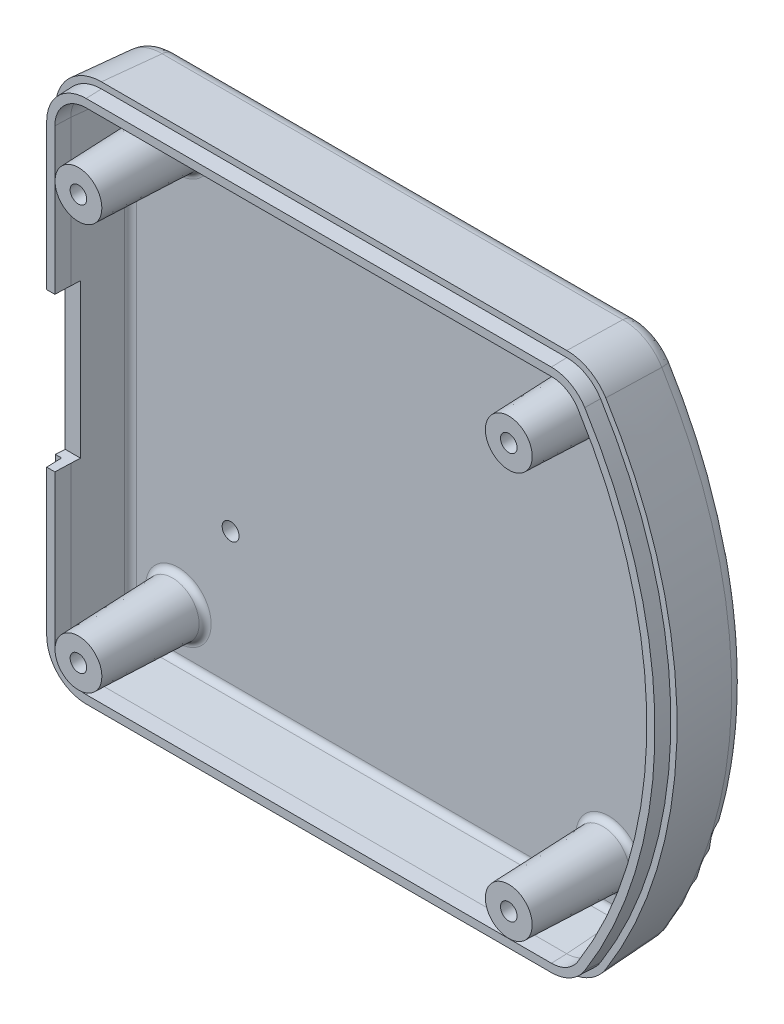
SolidWorks part; units mm, degrees
ref_plane "Front" through (0, 0, 0) normal (0, 0, 1) x (1, 0, 0)
ref_plane "Top" through (0, 0, 0) normal (0, 1, 0) x (1, 0, 0)
ref_plane "Right" through (0, 0, 0) normal (1, 0, 0) x (0, 0, -1)
sketch "Sketch1" plane through (0, 0, 0) normal (0, 0, 1) x (1, 0, 0)
  line L0 (0, 0) -> (0, 87.63)
  line L1 (0, 87.63) -> (87.63, 87.63)
  line L2 (0, 0) -> (87.63, 0)
  arc A0 (87.63, 87.63) -> (87.63, 0) centre (25.2867, 43.815) cw
  dimension "D3" = 76.2
  dimension "D1" = 87.63
  dimension "D2" = 87.63
extrude "Boss-Extrude1" add sketch "Sketch1" along normal blind 11.938 draft 3
fillet "Fillet1" radius 7.62 4 edges at (-0.3128, 87.9428, 5.969) (-0.3128, -0.3128, 5.969)
fillet "Fillet2" radius 2.54 8 edges at (86.062, 87.2012, 0) (101.4867, 43.815, 0) (88.3125, 1.6798, 0) (45.5764, 0, 0) (2.2275, 2.2275, 0) (0, 43.815, 0) (2.2275, 85.4025, 0) (45.5764, 87.63, 0)
shell "Shell1" thickness 2.54
sketch "Sketch2" plane through (0, 0, 2.54) normal (0, 0, 1) x (1, 0, 0)
  line L0 (-0.6256, 80.6461) -> (-0.6256, 6.9839) construction
  line L1 (83.8899, 88.2556) -> (6.9839, 88.2556) construction
  line L2 (6.9839, -0.6256) -> (83.8899, -0.6256) construction
  circle A0 centre (10.2964, 77.3336) radius 4.445
  circle A1 centre (81.4164, 77.3336) radius 4.445
  circle A2 centre (10.2964, 10.2964) radius 4.445
  circle A3 centre (81.4164, 10.2964) radius 4.445
  dimension "D5" = 8.89
  dimension "D1" = 10.922
  dimension "D2" = 10.922
  dimension "D3" = 10.922
  dimension "D4" = 71.12
extrude "Boss-Extrude2" add sketch "Sketch2" along normal blind 16.51 draft 2
sketch "Sketch3" plane through (0, 0, 11.938) normal (0, 0, 1) x (1, 0, 0)
  line L0 (1.9178, 80.6391) -> (1.9178, 6.9909) construction
  line L1 (6.9909, 1.9178) -> (83.8861, 1.9178) construction
  line L2 (83.8861, 85.7122) -> (6.9909, 85.7122) construction
  line L3 (1.9178, 80.6391) -> (1.9178, 6.9909)
  line L4 (6.9909, 1.9178) -> (83.8861, 1.9178)
  line L5 (83.8861, 85.7122) -> (6.9909, 85.7122)
  line L6 (83.8861, 87.2362) -> (6.9909, 87.2362)
  line L7 (0.3938, 80.6391) -> (0.3938, 6.9909)
  line L8 (6.9909, 0.3938) -> (83.8861, 0.3938)
  arc A0 (88.1814, 4.2917) -> (88.1814, 83.3383) centre (25.2867, 43.815) ccw construction
  arc A1 (88.1814, 4.2917) -> (88.1814, 83.3383) centre (25.2867, 43.815) ccw
  arc A2 (89.4718, 3.4808) -> (89.4718, 84.1492) centre (25.2867, 43.815) ccw
  ellipse E0 centre (7.0048, 7.0048) end of major axis (10.6068, 10.6068) minor radius 5.08 (1.9178, 6.9909) -> (6.9909, 1.9178) ccw construction
  ellipse E1 centre (7.0048, 80.6252) end of major axis (10.6068, 77.0232) minor radius 5.08 (6.9909, 85.7122) -> (1.9178, 80.6391) ccw construction
  ellipse E2 centre (7.0048, 7.0048) end of major axis (10.6068, 10.6068) minor radius 5.08 (1.9178, 6.9909) -> (6.9909, 1.9178) ccw
  ellipse E3 centre (7.0048, 80.6252) end of major axis (10.6068, 77.0232) minor radius 5.08 (6.9909, 85.7122) -> (1.9178, 80.6391) ccw
  spline S0 degree 3 poles (-352.9427, 1952.938) (-42.4044, 336.2998) (51.3055, -6.638) (85.3581, 2.1313) (85.5637, 2.1983) (85.9616, 2.3568) (86.3463, 2.539) (86.7053, 2.7677) (87.0511, 3.0203) (87.2173, 3.1587) (112.904, 27.459) (-130.76, 291.7886) (-1332.5102, 1410.9211) knots -20.245108 -20.245108 -20.245108 -20.245108 0.25 0.25 0.375 0.375 0.5 0.625 0.625 0.75 0.75 21.353867 21.353867 21.353867 21.353867 only from (83.8861, 1.9178) to (88.1814, 4.2917) construction
  spline S1 degree 3 poles (-1331.3243, -1324.6049) (-127.7442, -201.5063) (112.7608, 60.3047) (87.2175, 84.4711) (87.0513, 84.6095) (86.7055, 84.8622) (86.3465, 85.0909) (85.9618, 85.2732) (85.564, 85.4315) (85.3583, 85.4986) (51.1156, 94.3183) (-43.0484, -252.6452) (-351.2137, -1865.6879) knots -20.245101 -20.245101 -20.245101 -20.245101 0.25 0.25 0.375 0.375 0.5 0.625 0.625 0.75 0.75 21.354193 21.354193 21.354193 21.354193 only from (88.1814, 83.3383) to (83.8861, 85.7122) construction
  spline S2 degree 3 poles (83.8861, 1.9178) (84.317, 1.9178) (84.7388, 1.9718) (85.3581, 2.1313) (85.5637, 2.1983) (85.9616, 2.3568) (86.3463, 2.539) (86.7053, 2.7677) (87.0511, 3.0203) (87.2173, 3.1587) (87.682, 3.5983) (87.9521, 3.9268) (88.1814, 4.2917) knots 0 0 0 0 0.25 0.25 0.375 0.375 0.5 0.625 0.625 0.75 0.75 1 1 1 1
  spline S3 degree 3 poles (88.1814, 83.3383) (87.9521, 83.7032) (87.682, 84.0316) (87.2175, 84.4711) (87.0513, 84.6095) (86.7055, 84.8622) (86.3465, 85.0909) (85.9618, 85.2732) (85.564, 85.4315) (85.3583, 85.4986) (84.7389, 85.6582) (84.317, 85.7122) (83.8861, 85.7122) knots 0 0 0 0 0.25 0.25 0.375 0.375 0.5 0.625 0.625 0.75 0.75 1 1 1 1
  spline S4 degree 1 poles (89.4718, 84.1492) (83.8861, 87.2362) knots 0 0 1 1 construction
  spline S5 degree 1 poles (6.9909, 87.2362) (0.3938, 80.6391) knots 0 0 1 1 construction
  spline S6 degree 1 poles (0.3938, 6.9909) (6.9909, 0.3938) knots 0 0 1 1 construction
  spline S7 degree 1 poles (83.8861, 0.3938) (89.4718, 3.4808) knots 0 0 1 1 construction
  spline S8 degree 3 poles (89.4718, 84.1492) (88.8873, 85.0793) (87.2185, 86.6686) (84.9846, 87.2362) (83.8861, 87.2362) knots 0 0 0 0 0.5 1 1 1 1
  spline S9 degree 3 poles (6.9909, 87.2362) (6.1327, 87.2362) (4.3973, 86.8933) (2.2044, 85.4256) (0.7367, 83.2327) (0.3938, 81.4973) (0.3938, 80.6391) knots 2.357564 2.357564 2.357564 2.357564 2.749578 3.141593 3.533607 3.925621 3.925621 3.925621 3.925621
  spline S10 degree 3 poles (0.3938, 6.9909) (0.3938, 6.1327) (0.7367, 4.3973) (2.2044, 2.2044) (4.3973, 0.7367) (6.1327, 0.3938) (6.9909, 0.3938) knots 2.357564 2.357564 2.357564 2.357564 2.749578 3.141593 3.533607 3.925621 3.925621 3.925621 3.925621
  spline S11 degree 3 poles (83.8861, 0.3938) (84.9845, 0.3938) (87.2182, 0.9612) (88.8873, 2.5507) (89.4718, 3.4808) knots 0 0 0 0 0.5 1 1 1 1
  dimension "D1" = 1.524
extrude "Boss-Extrude3" add sketch "Sketch3" along normal blind 2.54 draft 2
sketch "Sketch4" plane through (0, 0, 19.05) normal (0, 0, 1) x (1, 0, 0)
  circle A0 centre (81.4164, 10.2964) radius 1.3716
  circle A1 centre (10.2964, 10.2964) radius 1.3716
  circle A2 centre (81.4164, 77.3336) radius 1.3716
  circle A3 centre (10.2964, 77.3336) radius 1.3716
  dimension "D1" = 2.7432
extrude "Cut-Extrude1" cut sketch "Sketch4" against normal blind 12.7
fillet "Fillet3" radius 1.016 12 edges at (86.7887, 3.527, 2.54) (99.0763, 43.815, 2.54) (86.7888, 84.103, 2.54) (45.5483, 85.2196, 2.54) (3.8954, 83.7346, 2.54) (2.4104, 43.815, 2.54) (3.8954, 3.8954, 2.54) (76.9714, 77.3336, 2.54) (5.8514, 77.3336, 2.54) (5.8514, 10.2964, 2.54) (76.9714, 10.2964, 2.54) (45.5483, 2.4104, 2.54)
sketch "Sketch5" plane through (0, 0, 0) normal (0, 0, -1) x (-1, 0, 0)
  line L1 (-14.6144, 10.2964) -> (-35.4424, 10.2964)
  line L2 (-12.0744, 12.8364) -> (-12.0744, 74.8124)
  line L3 (-14.6144, 77.3524) -> (-35.4424, 77.3524)
  line L4 (-37.9824, 12.8364) -> (-37.9824, 74.8124)
  line L5 (0.6256, 80.6461) -> (0.6256, 6.9839) construction
  line L6 (-6.9839, -0.6256) -> (-83.8899, -0.6256) construction
  arc A0 (-12.0744, 12.8364) -> (-14.6144, 10.2964) centre (-14.6144, 12.8364) cw
  arc A1 (-35.4424, 10.2964) -> (-37.9824, 12.8364) centre (-35.4424, 12.8364) cw
  arc A2 (-12.0744, 74.8124) -> (-14.6144, 77.3524) centre (-14.6144, 74.8124) ccw
  arc A3 (-35.4424, 77.3524) -> (-37.9824, 74.8124) centre (-35.4424, 74.8124) ccw
  point P16 (-12.0744, 77.3524)
  point P19 (-37.9824, 77.3524)
  dimension "D5" = 2.54
  dimension "D1" = 67.056
  dimension "D2" = 12.7
  dimension "D3" = 10.922
  dimension "D4" = 25.908
extrude "Cut-Extrude2" cut sketch "Sketch5" against normal blind 0.2032
hole_wizard "#35 (0.11) Diameter Hole1" positions "Sketch7" profile "Sketch6" hole size "#35" standard "ANSI Inch"
sketch "Sketch7" plane through (0, 0, 0) normal (0, 0, -1) x (-1, 0, 0)
  line L0 (-83.8899, 88.2556) -> (-6.9839, 88.2556) construction
  line L1 (-1.8291, 80.6391) -> (-1.8291, 6.9909) construction
  point P0 (-18.9372, 25.207)
  dimension "D1" = 63.0487
  dimension "D2" = 17.1081
sketch "Sketch6" plane through (18.9372, 25.207, 0) normal (1, 0, 0) x (0, 1, 0)
  line L0 (0, 0) -> (0, 19.05)
  line L1 (0, 19.05) -> (1.397, 19.05)
  line L2 (1.397, 19.05) -> (1.397, 0)
  line L5 (1.397, 0) -> (0, 0)
  line L11 (0, -6.35) -> (0, 107.95) construction
  dimension "Thru Hole Dia." = 2.794
  dimension "Thru Hole Depth" = 19.05
sketch "Sketch8" plane through (0, 0, 2.54) normal (0, 0, 1) x (1, 0, 0)
  line L0 (83.8899, 88.2556) -> (6.9839, 88.2556) construction
  line L1 (-0.6256, 80.6461) -> (-0.6256, 6.9839) construction
  circle A0 centre (47.6344, 43.8056) radius 41.275 construction
  point P2 (45.4369, 88.2556)
  point P5 (-0.6256, 43.815)
  dimension "D1" = 82.55
  dimension "D2" = 44.45
  dimension "D3" = 48.26
sketch "Sketch9" plane through (0, 0, 0) normal (1, 0, 0) x (0, 0, -1)
  line L0 (0, 7.4834) -> (0, 80.1466) construction
  line L1 (-10.4, 56.5244) -> (-15, 56.5244)
  line L2 (-10.4, 56.5244) -> (-10.4, 31.1244)
  line L3 (-10.4, 31.1244) -> (-15, 31.1244)
  line L4 (-15, 56.5244) -> (-15, 31.1244)
  dimension "D1" = 25.4
  dimension "D2" = 4.6
  dimension "D3" = 10.4
  dimension "D4" = 31.75
extrude "Cut-Extrude3" cut sketch "Sketch9" against normal mid plane 10.16
equation "\"D2@Sketch2\"=\"D1@Sketch2\""
equation "\"D3@Sketch2\"=\"D1@Sketch2\""
equation "\"D3@Sketch9\"=.5in - 2.3mm"
